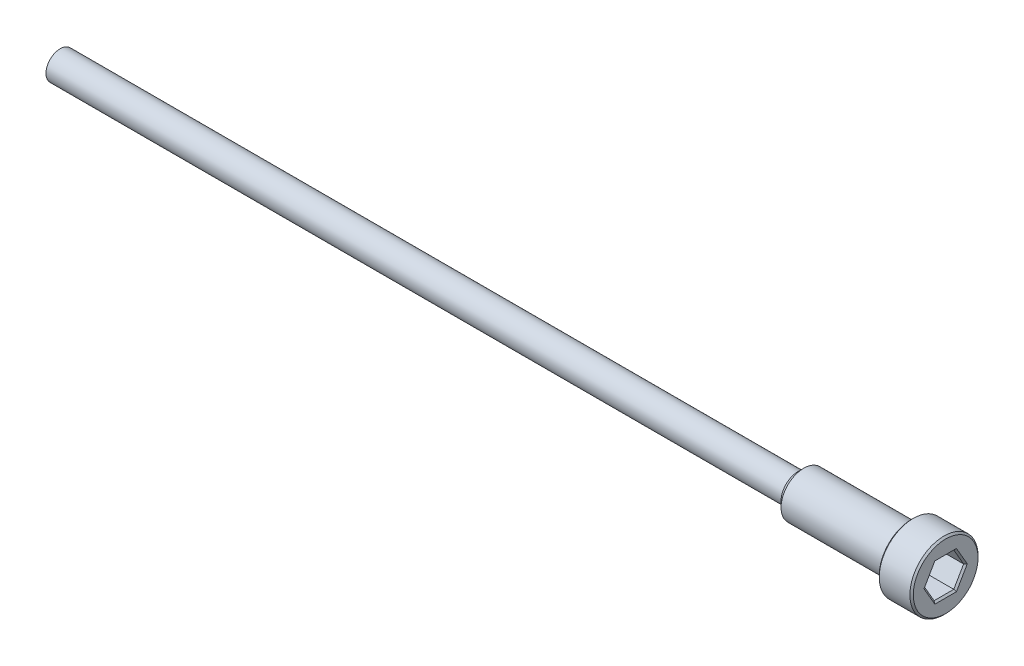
SolidWorks part; units mm, degrees
ref_plane "Front Plane" through (0, 0, 0) normal (0, 0, 1) x (1, 0, 0)
ref_plane "Top Plane" through (0, 0, 0) normal (0, 1, 0) x (1, 0, 0)
ref_plane "Right Plane" through (0, 0, 0) normal (1, 0, 0) x (0, 0, -1)
sketch "Sketch1" plane through (0, 0, 0) normal (1, 0, 0) x (0, 0, -1)
  circle A0 centre (0, 0) radius 2.5
  dimension "D1" = 5
extrude "Extrude1" add sketch "Sketch1" along normal blind 130
sketch "Sketch2" plane through (130, 0, 0) normal (1, 0, 0) x (0, 0, -1)
  circle A0 centre (0, 0) radius 4
  dimension "D1" = 8
extrude "Extrude2" add sketch "Sketch2" along normal blind 20
chamfer "Chamfer1" distance 1 angle 45 1 edges at (130, 0, -4)
sketch "Sketch4" plane through (150, 0, 0) normal (1, 0, 0) x (0, 0, -1)
  circle A0 centre (0, 0) radius 6
  dimension "D1" = 12
extrude "Extrude3" add sketch "Sketch4" along normal blind 6
sketch "Sketch5" plane through (156, 0, 0) normal (1, 0, 0) x (0, 0, -1)
  line L0 (-1.7321, 3) -> (1.7321, 3)
  line L1 (1.7321, 3) -> (3.4641, 0)
  line L2 (3.4641, 0) -> (1.7321, -3)
  line L3 (1.7321, -3) -> (-1.7321, -3)
  line L4 (-1.7321, -3) -> (-3.4641, 0)
  line L5 (-3.4641, 0) -> (-1.7321, 3)
  circle A0 centre (0, 0) radius 3
  dimension "D1" = 6
extrude "Cut-Extrude1" cut sketch "Sketch5" against normal blind 6 contours L5 L0 L1 L2 L3 L4
chamfer "Chamfer2" distance 0.3 angle 45 8 edges at (156, 1.5, 2.5981) (156, -1.5, 2.5981) (156, -3, 0) (156, -1.5, -2.5981) (156, 1.5, -2.5981) (156, 3, 0) (150, 0, -6) (156, 0, -6)
